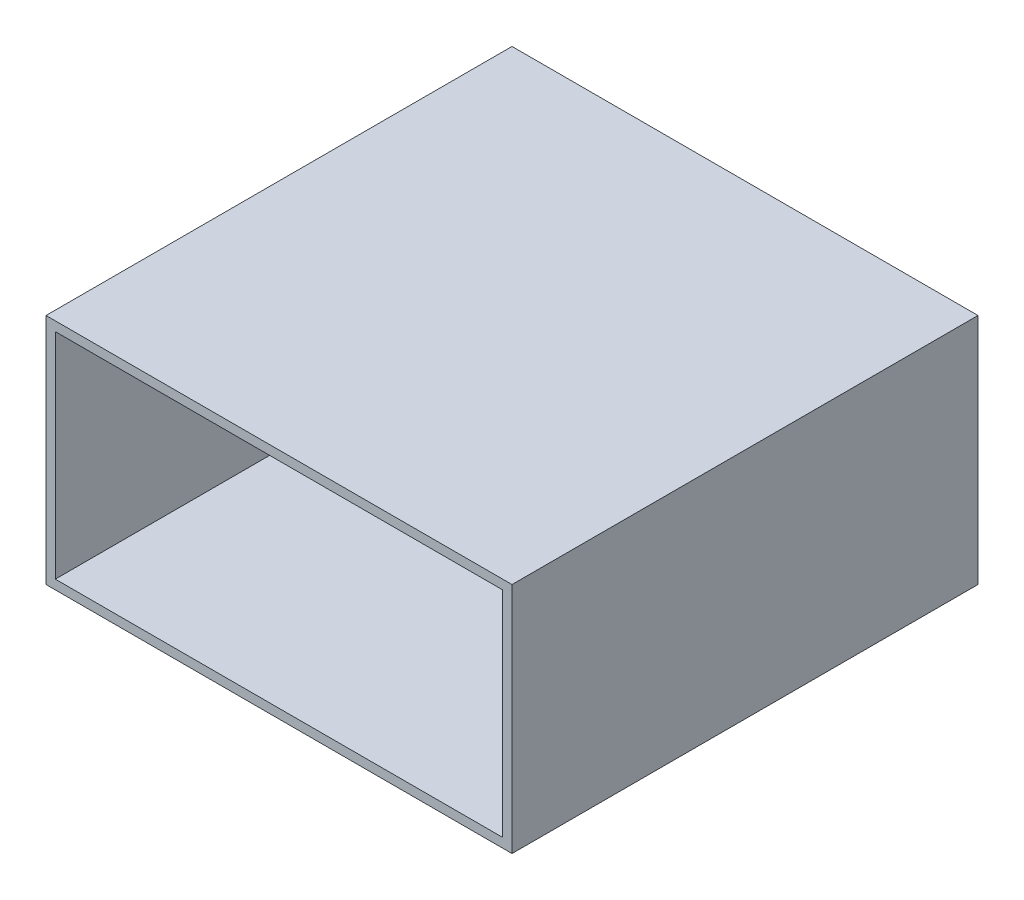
SolidWorks part; units mm, degrees
ref_plane "正面" through (0, 0, 0) normal (0, 0, 1) x (1, 0, 0)
ref_plane "平面" through (0, 0, 0) normal (0, 1, 0) x (1, 0, 0)
ref_plane "右側面" through (0, 0, 0) normal (1, 0, 0) x (0, 0, -1)
sketch "ｽｹｯﾁ1" plane through (0, 0, 0) normal (0, 1, 0) x (1, 0, 0)
  line L1 (-50, -50) -> (50, -50)
  line L2 (-50, -50) -> (-50, 50)
  line L3 (-50, 50) -> (50, 50)
  line L4 (50, -50) -> (50, 50)
  line L5 (-50, -50) -> (50, 50) construction
  line L6 (-50, 50) -> (50, -50) construction
  point P0 (0, 0)
  dimension "D1" = 100
extrude "ﾎﾞｽ - 押し出し1" add sketch "ｽｹｯﾁ1" along normal blind 50
shell "ｼｪﾙ1" thickness 2
